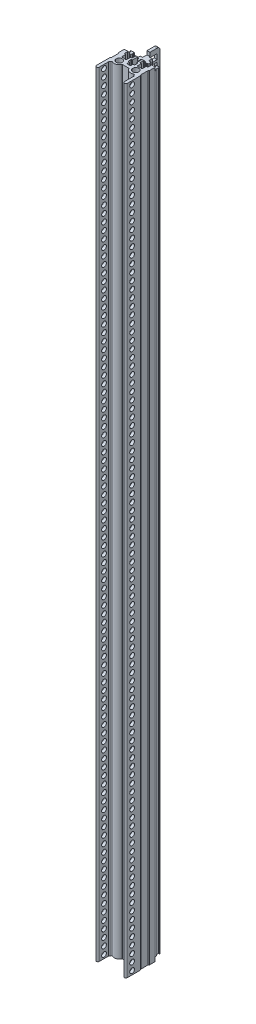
SolidWorks part; units mm, degrees
ref_plane "前视基准面" through (0, 0, 0) normal (0, 0, 1) x (1, 0, 0)
ref_plane "上视基准面" through (0, 0, 0) normal (0, 1, 0) x (1, 0, 0)
ref_plane "右视基准面" through (0, 0, 0) normal (1, 0, 0) x (0, 0, -1)
sketch "草图1" plane through (0, 0, 0) normal (0, 1, 0) x (1, 0, 0)
  line L0 (-2.825, 13.6) -> (-3.725, 13.6)
  line L1 (-8.025, 13.6) -> (-8.025, 11.3)
  line L2 (-3.725, 11.3) -> (-2.825, 11.3)
  line L3 (-3.725, 7.5298) -> (-3.725, 11.3)
  line L4 (-7.125, 11.3) -> (-7.125, 7.8763)
  line L5 (-8.025, 11.3) -> (-7.125, 11.3)
  line L6 (-2.825, 13.6) -> (-2.825, 11.3)
  line L7 (-7.125, 13.6) -> (-8.025, 13.6)
  line L8 (-7.125, 14.6) -> (-7.125, 13.6)
  line L9 (-8.025, 14.6) -> (-7.125, 14.6)
  line L10 (-8.025, 15.8) -> (-8.025, 14.6)
  line L11 (-7.125, 15.8) -> (-8.025, 15.8)
  line L12 (-5.675, 5.25) -> (5.675, 5.25) construction
  line L13 (0, 5.25) -> (0, 10.7319) construction
  line L15 (-10.275, 14.8) -> (-10.275, 13.75)
  line L16 (-9.525, 16.95) -> (-9.525, 15.2)
  line L17 (-10.275, 12.95) -> (-10.375, 12.95) construction
  line L18 (-10.675, 12.65) -> (-10.375, 12.95) construction
  line L19 (-10.675, 9.65) -> (-10.675, 12.65)
  line L20 (-10.2249, 9.1498) -> (-10.675, 9.65)
  line L21 (-10.2249, 9.1498) -> (-10.2251, 4.1498)
  line L22 (-10.675, 3.65) -> (-10.2251, 4.1498)
  line L23 (-10.675, -5.5) -> (-10.675, 3.65)
  line L24 (-8.675, -4.1) -> (-8.675, 0)
  line L25 (-0.675, 20.25) -> (-0.675, 17.75)
  line L26 (-2.075, 20.25) -> (-0.675, 20.25)
  line L27 (-2.075, 17.75) -> (-2.075, 20.25)
  line L28 (-3.725, 17.75) -> (-2.075, 17.75)
  line L29 (-3.725, 15.8) -> (-3.725, 17.75)
  line L30 (-2.825, 15.8) -> (-3.725, 15.8)
  line L31 (-2.825, 14.6) -> (-2.825, 15.8)
  line L32 (-3.725, 14.6) -> (-2.825, 14.6)
  line L33 (-3.725, 13.6) -> (-3.725, 14.6)
  line L34 (-10.675, -5.5) -> (-10.675, 3.65)
  line L35 (-8.675, -5.5) -> (-8.675, 0)
  line L36 (-0.675, 20.25) -> (-0.675, 17.75)
  line L37 (0.675, 20.25) -> (0.675, 17.75)
  line L38 (-2.075, 20.25) -> (-0.675, 20.25)
  line L39 (-2.075, 17.75) -> (-2.075, 20.25)
  line L40 (-3.725, 17.75) -> (-2.075, 17.75)
  line L41 (-3.725, 15.8) -> (-3.725, 17.75)
  line L42 (-2.825, 15.8) -> (-3.725, 15.8)
  line L43 (-2.825, 14.6) -> (-2.825, 15.8)
  line L44 (-3.725, 14.6) -> (-2.825, 14.6)
  line L45 (-3.725, 13.6) -> (-3.725, 14.6)
  line L46 (-2.825, 13.6) -> (-3.725, 13.6)
  line L47 (2.825, 13.6) -> (2.825, 11.3)
  line L48 (-3.725, 11.3) -> (-2.825, 11.3)
  line L49 (-3.725, 7.5298) -> (-3.725, 11.3)
  line L50 (-7.125, 11.3) -> (-7.125, 7.8763)
  line L51 (-8.025, 11.3) -> (-7.125, 11.3)
  line L52 (2.825, 11.3) -> (2.8554, 11.3157)
  line L53 (-7.125, 13.6) -> (-8.025, 13.6)
  line L54 (-7.125, 14.6) -> (-7.125, 13.6)
  line L55 (-8.025, 14.6) -> (-7.125, 14.6)
  line L56 (-8.025, 15.8) -> (-8.025, 14.6)
  line L57 (-7.125, 15.8) -> (-8.025, 15.8)
  line L58 (-10.275, 13.75) -> (-10.375, 13.75)
  line L59 (-9.725, 15) -> (-10.075, 15)
  line L60 (-7.875, 17.75) -> (-9.675, 17.75)
  line L61 (-9.675, 17.75) -> (-9.7164, 17.7086)
  line L62 (-10.225, 17.45) -> (-10.225, 17.35)
  line L63 (-10.275, 12.95) -> (-10.375, 12.95) construction
  line L64 (-10.675, 12.65) -> (-10.375, 12.95) construction
  line L65 (-10.675, 9.65) -> (-10.675, 12.65)
  line L66 (-10.2249, 9.1498) -> (-10.675, 9.65)
  line L67 (-10.2249, 9.1498) -> (-10.2251, 4.1498)
  line L68 (-10.2251, 4.1498) -> (-10.2251, 6.4588)
  line L69 (2.825, 13.6) -> (3.725, 13.6)
  line L70 (8.025, 13.6) -> (8.025, 11.3)
  line L71 (3.725, 11.3) -> (2.825, 11.3)
  line L72 (3.725, 7.5298) -> (3.725, 11.3)
  line L73 (7.125, 11.3) -> (7.125, 7.8763)
  line L74 (8.025, 11.3) -> (7.125, 11.3)
  line L75 (-10.025, 17.15) -> (-9.725, 17.15)
  line L76 (7.125, 13.6) -> (8.025, 13.6)
  line L77 (7.125, 14.6) -> (7.125, 13.6)
  line L78 (8.025, 14.6) -> (7.125, 14.6)
  line L79 (8.025, 15.8) -> (8.025, 14.6)
  line L80 (7.125, 15.8) -> (8.025, 15.8)
  line L81 (-9.8578, 17.65) -> (-10.025, 17.65)
  line L82 (-7.8336, 17.7086) -> (-7.875, 17.75)
  line L83 (-7.325, 17.35) -> (-7.325, 17.45)
  line L85 (7.125, 15.8) -> (7.125, 15.8672)
  line L86 (10.275, 12.95) -> (10.375, 12.95) construction
  line L87 (10.675, 12.65) -> (10.375, 12.95) construction
  line L88 (10.675, 9.65) -> (10.675, 12.65)
  line L89 (10.2249, 9.1498) -> (10.675, 9.65)
  line L90 (10.2249, 9.1498) -> (10.2251, 4.1498)
  line L91 (10.675, 3.65) -> (10.2251, 4.1498)
  line L92 (10.675, -5.5) -> (10.675, 3.65)
  line L93 (8.675, -4.1) -> (8.675, 0)
  line L94 (0.675, 20.25) -> (0.675, 17.75)
  line L95 (2.075, 20.25) -> (0.675, 20.25)
  line L96 (2.075, 17.75) -> (2.075, 20.25)
  line L97 (3.725, 17.75) -> (2.075, 17.75)
  line L98 (3.725, 15.8) -> (3.725, 17.75)
  line L99 (2.825, 15.8) -> (3.725, 15.8)
  line L100 (2.825, 14.6) -> (2.825, 15.8)
  line L101 (3.725, 14.6) -> (2.825, 14.6)
  line L102 (3.725, 13.6) -> (3.725, 14.6)
  line L103 (10.675, -5.5) -> (10.675, 3.65)
  line L104 (8.675, -5.5) -> (8.675, 0)
  line L105 (8.675, 0) -> (-8.675, 0)
  line L106 (0.675, 20.25) -> (0.675, 17.75)
  line L107 (2.075, 20.25) -> (0.675, 20.25)
  line L108 (2.075, 17.75) -> (2.075, 20.25)
  line L109 (3.725, 17.75) -> (2.075, 17.75)
  line L110 (3.725, 15.8) -> (3.725, 17.75)
  line L111 (2.825, 15.8) -> (3.725, 15.8)
  line L112 (2.825, 14.6) -> (2.825, 15.8)
  line L113 (3.725, 14.6) -> (2.825, 14.6)
  line L114 (3.725, 13.6) -> (3.725, 14.6)
  line L115 (2.825, 13.6) -> (3.725, 13.6)
  line L116 (7.1836, 16.0086) -> (7.7664, 16.5914)
  line L117 (3.725, 11.3) -> (2.825, 11.3)
  line L118 (3.725, 7.5298) -> (3.725, 11.3)
  line L119 (7.125, 11.3) -> (7.125, 7.8763)
  line L120 (8.025, 11.3) -> (7.125, 11.3)
  line L121 (7.825, 16.7328) -> (7.825, 16.95)
  line L122 (7.125, 13.6) -> (8.025, 13.6)
  line L123 (7.125, 14.6) -> (7.125, 13.6)
  line L124 (8.025, 14.6) -> (7.125, 14.6)
  line L125 (8.025, 15.8) -> (8.025, 14.6)
  line L126 (7.125, 15.8) -> (8.025, 15.8)
  line L127 (7.625, 17.15) -> (7.525, 17.15)
  line L128 (7.325, 17.35) -> (7.325, 17.45)
  line L129 (7.525, 17.65) -> (7.6922, 17.65)
  line L130 (7.8336, 17.7086) -> (7.875, 17.75)
  line L131 (9.725, 15) -> (10.075, 15)
  line L132 (10.275, 12.95) -> (10.375, 12.95) construction
  line L133 (10.675, 12.65) -> (10.375, 12.95) construction
  line L134 (10.675, 9.65) -> (10.675, 12.65)
  line L135 (10.2249, 9.1498) -> (10.675, 9.65)
  line L136 (10.2249, 9.1498) -> (10.2251, 4.1498)
  line L137 (10.2251, 4.1498) -> (10.2251, 6.4588)
  line L138 (-0.675, 17.75) -> (0.675, 17.75)
  line L139 (-7.125, 16.775) -> (-3.725, 16.775) construction
  line L140 (-5.425, 16.775) -> (-5.425, 11.3) construction
  line L141 (3.725, 16.775) -> (7.125, 16.775) construction
  line L142 (5.425, 16.775) -> (5.425, 12.65) construction
  line L143 (9.8578, 17.65) -> (10.025, 17.65)
  line L144 (10.025, 17.15) -> (9.725, 17.15)
  line L145 (10.225, 17.45) -> (10.225, 17.35)
  line L146 (9.675, 17.75) -> (9.7164, 17.7086)
  line L147 (9.525, 16.95) -> (9.525, 15.2)
  line L148 (7.875, 17.75) -> (9.675, 17.75)
  line L149 (10.275, 14.8) -> (10.275, 13.75)
  line L150 (-7.825, 16.7328) -> (-7.825, 16.95)
  line L151 (-7.125, 15.8) -> (-7.125, 15.8672)
  line L152 (-7.525, 17.65) -> (-7.6922, 17.65)
  line L153 (-7.625, 17.15) -> (-7.525, 17.15)
  line L154 (-7.1836, 16.0086) -> (-7.7664, 16.5914)
  line L155 (-10.375, 13.75) -> (-10.675, 13.45)
  line L156 (-10.675, 13.45) -> (-10.675, 12.65)
  line L157 (10.675, 13.45) -> (10.675, 12.65)
  line L158 (10.375, 13.75) -> (10.675, 13.45)
  line L159 (10.275, 13.75) -> (10.375, 13.75)
  arc A1 (-10.675, -5.5) -> (-8.675, -5.5) centre (-9.675, -5.5) ccw
  arc A2 (-10.675, -5.5) -> (-8.675, -5.5) centre (-9.675, -5.5) ccw
  circle A4 centre (-5.675, 5.25) radius 1.6
  arc A6 (8.675, -5.5) -> (10.675, -5.5) centre (9.675, -5.5) ccw
  arc A7 (8.675, -5.5) -> (10.675, -5.5) centre (9.675, -5.5) ccw
  circle A9 centre (5.675, 5.25) radius 1.6
  arc A10 (7.1836, 16.0086) -> (7.125, 15.8672) centre (7.325, 15.8672) ccw
  arc A11 (7.7664, 16.5914) -> (7.825, 16.7328) centre (7.625, 16.7328) ccw
  arc A12 (7.825, 16.95) -> (7.625, 17.15) centre (7.625, 16.95) ccw
  arc A13 (7.325, 17.35) -> (7.525, 17.15) centre (7.525, 17.35) ccw
  arc A14 (7.525, 17.65) -> (7.325, 17.45) centre (7.525, 17.45) ccw
  arc A15 (10.275, 14.8) -> (10.075, 15) centre (10.075, 14.8) ccw
  arc A16 (10.225, 17.45) -> (10.025, 17.65) centre (10.025, 17.45) ccw
  arc A17 (9.725, 17.15) -> (9.525, 16.95) centre (9.725, 16.95) ccw
  arc A18 (10.025, 17.15) -> (10.225, 17.35) centre (10.025, 17.35) ccw
  arc A19 (9.7164, 17.7086) -> (9.8578, 17.65) centre (9.8578, 17.85) ccw
  arc A20 (9.525, 15.2) -> (9.725, 15) centre (9.725, 15.2) ccw
  arc A21 (7.6922, 17.65) -> (7.8336, 17.7086) centre (7.6922, 17.85) ccw
  arc A22 (-9.525, 15.2) -> (-9.725, 15) centre (-9.725, 15.2) cw
  arc A23 (-10.275, 14.8) -> (-10.075, 15) centre (-10.075, 14.8) cw
  arc A24 (-9.7164, 17.7086) -> (-9.8578, 17.65) centre (-9.8578, 17.85) cw
  arc A25 (-10.025, 17.15) -> (-10.225, 17.35) centre (-10.025, 17.35) cw
  arc A26 (-9.725, 17.15) -> (-9.525, 16.95) centre (-9.725, 16.95) cw
  arc A27 (-10.225, 17.45) -> (-10.025, 17.65) centre (-10.025, 17.45) cw
  arc A28 (-7.7664, 16.5914) -> (-7.825, 16.7328) centre (-7.625, 16.7328) cw
  arc A29 (-7.1836, 16.0086) -> (-7.125, 15.8672) centre (-7.325, 15.8672) cw
  arc A30 (-7.6922, 17.65) -> (-7.8336, 17.7086) centre (-7.6922, 17.85) cw
  arc A31 (-7.525, 17.65) -> (-7.325, 17.45) centre (-7.525, 17.45) cw
  arc A32 (-7.325, 17.35) -> (-7.525, 17.15) centre (-7.525, 17.35) cw
  arc A33 (-7.825, 16.95) -> (-7.625, 17.15) centre (-7.625, 16.95) cw
  arc A34 (-3.725, 7.5298) -> (-7.125, 7.8763) centre (-5.675, 5.25) ccw
  arc A35 (7.125, 7.8763) -> (3.725, 7.5298) centre (5.675, 5.25) ccw
  dimension "D4" = 11.35
  dimension "D5" = 3.2
  dimension "D6" = 6
  dimension "D7" = 0.1
  dimension "D1" = 5.2
  dimension "D2" = 5.2
  dimension "D3" = 15
  dimension "D8" = 0.8
extrude "凸台-拉伸1" add sketch "草图1" along normal mid plane 533.4
sketch "草图4" plane through (0, 266.7, 0) normal (0, 1, 0) x (1, 0, 0)
  line L1 (-2.075, 17.75) -> (-0.075, 17.75)
  line L2 (-2.075, 17.75) -> (-2.075, 27.75)
  line L3 (-2.075, 27.75) -> (-0.075, 27.75)
  line L4 (-0.075, 17.75) -> (-0.075, 27.75)
  dimension "D1" = 2
  dimension "D2" = 10
extrude "凸台-拉伸2" add sketch "草图4" against normal up to surface (533.4 mm away)
sketch "草图17" plane through (0, 266.7, 0) normal (0, 1, 0) x (1, 0, 0)
  line L0 (7.125, 13.6) -> (8.025, 13.6) construction
  line L1 (8.125, 13.6) -> (2.725, 13.6)
  line L2 (8.125, 13.6) -> (8.125, 11.1)
  line L3 (8.125, 11.1) -> (2.725, 11.1)
  line L4 (2.725, 13.6) -> (2.725, 11.1)
  line L5 (7.125, 15.8) -> (8.025, 15.8) construction
  line L6 (8.125, 15.8) -> (2.725, 15.8)
  line L7 (8.125, 15.8) -> (8.125, 14.6)
  line L8 (8.125, 14.6) -> (2.725, 14.6)
  line L9 (2.725, 15.8) -> (2.725, 14.6)
  line L10 (3.725, 14.6) -> (2.825, 14.6) construction
  line L11 (-2.825, 15.8) -> (-3.725, 15.8) construction
  line L12 (-2.725, 15.8) -> (-8.125, 15.8)
  line L13 (-2.725, 15.8) -> (-2.725, 14.6)
  line L14 (-2.725, 14.6) -> (-8.125, 14.6)
  line L15 (-8.125, 15.8) -> (-8.125, 14.6)
  line L16 (-8.025, 14.6) -> (-7.125, 14.6) construction
  line L17 (-2.825, 13.6) -> (-3.725, 13.6) construction
  line L18 (-2.725, 13.6) -> (-8.125, 13.6)
  line L19 (-2.725, 13.6) -> (-2.725, 11.1)
  line L20 (-2.725, 11.1) -> (-8.125, 11.1)
  line L21 (-8.125, 13.6) -> (-8.125, 11.1)
  line L22 (8.025, 13.6) -> (8.025, 11.3) construction
  line L23 (2.825, 13.6) -> (2.825, 11.3) construction
  line L24 (3.725, 11.3) -> (2.825, 11.3) construction
  line L25 (-2.825, 13.6) -> (-2.825, 11.3) construction
  line L26 (-8.025, 13.6) -> (-8.025, 11.3) construction
  dimension "D1" = 0.1
  dimension "D2" = 0.1
  dimension "D3" = 0.2
  dimension "D4" = 0.1
  dimension "D5" = 0.1
extrude "切除-拉伸10" cut sketch "草图17" against normal through all
fillet "圆角4" radius 0.2 16 edges at (8.125, 0, -11.1) (2.725, 0, -13.6) (8.125, 0, -13.6) (2.725, 0, -11.1) (8.125, 0, -14.6) (2.725, 0, -15.8) (8.125, 0, -15.8) (2.725, 0, -14.6) (-2.725, 0, -14.6) (-8.125, 0, -15.8) (-2.725, 0, -15.8) (-8.125, 0, -14.6) (-2.725, 0, -11.1) (-2.725, 0, -13.6) (-8.125, 0, -11.1) (-8.125, 0, -13.6)
sketch "草图14" plane through (0, 266.7, 0) normal (0, 1, 0) x (1, 0, 0)
  line L0 (-0.075, 17.75) -> (-0.575, 17.75)
  line L1 (-0.575, 17.75) -> (-0.575, 19.25)
  line L2 (-0.575, 19.25) -> (-0.075, 19.75)
  line L3 (-0.075, 17.75) -> (-0.075, 27.75) construction
  line L4 (-0.075, 19.75) -> (-0.075, 17.75)
  line L5 (0.675, 20.25) -> (1.675, 20.25)
  line L6 (2.075, 20.25) -> (0.675, 20.25) construction
  line L7 (1.675, 20.25) -> (0.675, 19.25)
  line L8 (0.675, 20.25) -> (0.675, 17.75) construction
  line L9 (0.675, 19.25) -> (0.675, 20.25)
  dimension "D1" = 45
  dimension "D2" = 0.5
  dimension "D3" = 0.5
  dimension "D4" = 1
  dimension "D5" = 1
extrude "切除-拉伸7" cut sketch "草图14" against normal through all
sketch "草图19" plane through (0, 266.7, 0) normal (0, 1, 0) x (1, 0, 0)
  line L1 (2.075, 20.25) -> (-0.575, 20.25)
  line L2 (2.075, 20.25) -> (2.075, 17.75)
  line L3 (2.075, 17.75) -> (-0.575, 17.75)
  line L4 (-0.575, 20.25) -> (-0.575, 17.75)
extrude "凸台-拉伸3" add sketch "草图19" against normal up to surface (533.4 mm away)
sketch "草图6" plane through (0, -266.7, 0) normal (0, -1, 0) x (-1, 0, 0)
  line L0 (0, 0) -> (0, 12.9416) construction
  line L1 (8.675, 0) -> (8.675, 1)
  line L2 (-7.6934, 2.3906) -> (-8.675, 1)
  line L3 (7.6934, 2.3906) -> (8.675, 1)
  line L4 (-8.675, 0) -> (-8.675, 1)
  line L5 (-3.725, 17.75) -> (-2.075, 17.75) construction
  line L7 (2.25, 7.75) -> (2.25, 10.25)
  line L8 (8.675, 0) -> (-8.675, 0)
  line L9 (8.675, -5.5) -> (8.675, 0) construction
  line L10 (-2.4058, 4) -> (2.4058, 4)
  line L11 (2.25, 10.25) -> (1.5, 10.25)
  line L12 (1.5, 10.25) -> (1.5, 16.25)
  line L13 (-1.5, 10.25) -> (-1.5, 16.25)
  line L14 (-2.25, 10.25) -> (-1.5, 10.25)
  line L15 (-2.25, 7.75) -> (-2.25, 10.25)
  line L16 (2.25, 7.75) -> (1.25, 7.75)
  line L17 (1.25, 7.75) -> (1.25, 6)
  line L18 (-1.25, 7.75) -> (-1.25, 6)
  line L19 (-2.25, 7.75) -> (-1.25, 7.75)
  line L20 (1.25, 6) -> (-1.25, 6)
  line L21 (1.5, 16.25) -> (-1.5, 16.25)
  arc A0 (2.4058, 4) -> (7.6934, 2.3906) centre (5.675, 5.25) ccw
  arc A1 (-2.4058, 4) -> (-7.6934, 2.3906) centre (-5.675, 5.25) cw
  dimension "D1" = 7
  dimension "D3" = 4
  dimension "D2" = 1
  dimension "D4" = 1.5
  dimension "D6" = 2
  dimension "D7" = 2.5
  dimension "D8" = 3
  dimension "D9" = 4.5
  dimension "D10" = 6
  dimension "D11" = 2.5
extrude "切除-拉伸4" cut sketch "草图6" against normal through all
sketch "草图2" plane through (10.675, 0, 0) normal (1, 0, 0) x (0, 0, -1)
  line L0 (20.25, 0) -> (52.8609, 0) construction
  line L1 (20.75, 266.7) -> (13.75, 266.7)
  line L2 (20.75, 266.7) -> (20.75, 264.16)
  line L3 (20.75, 264.16) -> (13.75, 264.16)
  line L4 (13.75, 266.7) -> (13.75, 264.16)
  line L5 (20.25, 266.7) -> (20.25, -266.7) construction
  line L6 (13.75, -266.7) -> (13.75, -264.16)
  line L7 (20.75, -264.16) -> (13.75, -264.16)
  line L8 (20.75, -266.7) -> (20.75, -264.16)
  line L9 (20.75, -266.7) -> (13.75, -266.7)
  line L11 (17.75, 266.7) -> (27.75, 266.7) construction
  line L12 (27.75, -266.7) -> (27.75, 266.7) construction
  dimension "D1" = 7
  dimension "D2" = 2.54
  dimension "D3" = 7
extrude "切除-拉伸1" cut sketch "草图2" against normal through all
sketch "草图3" plane through (10.675, 0, 0) normal (1, 0, 0) x (0, 0, -1)
  line L0 (-6.5, 266.7) -> (-6.5, -266.7) construction
  line L1 (-5.5, 266.7) -> (3.65, 266.7) construction
  circle A0 centre (-2.25, 264.16) radius 1.65
  circle A1 centre (-2.25, 259.08) radius 1.65
  circle A2 centre (-2.25, 254) radius 1.65
  circle A3 centre (-2.25, 248.92) radius 1.65
  circle A4 centre (-2.25, 243.84) radius 1.65
  circle A5 centre (-2.25, 238.76) radius 1.65
  circle A6 centre (-2.25, 233.68) radius 1.65
  circle A7 centre (-2.25, 228.6) radius 1.65
  circle A8 centre (-2.25, 223.52) radius 1.65
  circle A9 centre (-2.25, 218.44) radius 1.65
  circle A10 centre (-2.25, 213.36) radius 1.65
  circle A11 centre (-2.25, 208.28) radius 1.65
  circle A12 centre (-2.25, 203.2) radius 1.65
  circle A13 centre (-2.25, 198.12) radius 1.65
  circle A14 centre (-2.25, 193.04) radius 1.65
  circle A15 centre (-2.25, 187.96) radius 1.65
  circle A16 centre (-2.25, 182.88) radius 1.65
  circle A17 centre (-2.25, 177.8) radius 1.65
  circle A18 centre (-2.25, 172.72) radius 1.65
  circle A19 centre (-2.25, 167.64) radius 1.65
  circle A20 centre (-2.25, 162.56) radius 1.65
  circle A21 centre (-2.25, 157.48) radius 1.65
  circle A22 centre (-2.25, 152.4) radius 1.65
  circle A23 centre (-2.25, 147.32) radius 1.65
  circle A24 centre (-2.25, 142.24) radius 1.65
  circle A25 centre (-2.25, 137.16) radius 1.65
  circle A26 centre (-2.25, 132.08) radius 1.65
  circle A27 centre (-2.25, 127) radius 1.65
  circle A28 centre (-2.25, 121.92) radius 1.65
  circle A29 centre (-2.25, 116.84) radius 1.65
  circle A30 centre (-2.25, 111.76) radius 1.65
  circle A31 centre (-2.25, 106.68) radius 1.65
  circle A32 centre (-2.25, 101.6) radius 1.65
  circle A33 centre (-2.25, 96.52) radius 1.65
  circle A34 centre (-2.25, 91.44) radius 1.65
  circle A35 centre (-2.25, 86.36) radius 1.65
  circle A36 centre (-2.25, 81.28) radius 1.65
  circle A37 centre (-2.25, 76.2) radius 1.65
  circle A38 centre (-2.25, 71.12) radius 1.65
  circle A39 centre (-2.25, 66.04) radius 1.65
  circle A40 centre (-2.25, 60.96) radius 1.65
  circle A41 centre (-2.25, 55.88) radius 1.65
  circle A42 centre (-2.25, 50.8) radius 1.65
  circle A43 centre (-2.25, 45.72) radius 1.65
  circle A44 centre (-2.25, 40.64) radius 1.65
  circle A45 centre (-2.25, 35.56) radius 1.65
  circle A46 centre (-2.25, 30.48) radius 1.65
  circle A47 centre (-2.25, 25.4) radius 1.65
  circle A48 centre (-2.25, 20.32) radius 1.65
  circle A49 centre (-2.25, 15.24) radius 1.65
  circle A50 centre (-2.25, 10.16) radius 1.65
  circle A51 centre (-2.25, 5.08) radius 1.65
  circle A52 centre (-2.25, 0) radius 1.65
  circle A53 centre (-2.25, -5.08) radius 1.65
  circle A54 centre (-2.25, -10.16) radius 1.65
  circle A55 centre (-2.25, -15.24) radius 1.65
  circle A56 centre (-2.25, -20.32) radius 1.65
  circle A57 centre (-2.25, -25.4) radius 1.65
  circle A58 centre (-2.25, -30.48) radius 1.65
  circle A59 centre (-2.25, -35.56) radius 1.65
  circle A60 centre (-2.25, -40.64) radius 1.65
  circle A61 centre (-2.25, -45.72) radius 1.65
  circle A62 centre (-2.25, -50.8) radius 1.65
  circle A63 centre (-2.25, -55.88) radius 1.65
  circle A64 centre (-2.25, -60.96) radius 1.65
  circle A65 centre (-2.25, -66.04) radius 1.65
  circle A66 centre (-2.25, -71.12) radius 1.65
  circle A67 centre (-2.25, -76.2) radius 1.65
  circle A68 centre (-2.25, -81.28) radius 1.65
  circle A69 centre (-2.25, -86.36) radius 1.65
  circle A70 centre (-2.25, -91.44) radius 1.65
  circle A71 centre (-2.25, -96.52) radius 1.65
  circle A72 centre (-2.25, -101.6) radius 1.65
  circle A73 centre (-2.25, -106.68) radius 1.65
  circle A74 centre (-2.25, -111.76) radius 1.65
  circle A75 centre (-2.25, -116.84) radius 1.65
  circle A76 centre (-2.25, -121.92) radius 1.65
  circle A77 centre (-2.25, -127) radius 1.65
  circle A78 centre (-2.25, -132.08) radius 1.65
  circle A79 centre (-2.25, -137.16) radius 1.65
  circle A80 centre (-2.25, -142.24) radius 1.65
  circle A81 centre (-2.25, -147.32) radius 1.65
  circle A82 centre (-2.25, -152.4) radius 1.65
  circle A83 centre (-2.25, -157.48) radius 1.65
  circle A84 centre (-2.25, -162.56) radius 1.65
  circle A85 centre (-2.25, -182.88) radius 1.65
  circle A86 centre (-2.25, -213.36) radius 1.65
  circle A87 centre (-2.25, -177.8) radius 1.65
  circle A88 centre (-2.25, -233.68) radius 1.65
  circle A89 centre (-2.25, -193.04) radius 1.65
  circle A90 centre (-2.25, -218.44) radius 1.65
  circle A91 centre (-2.25, -172.72) radius 1.65
  circle A92 centre (-2.25, -203.2) radius 1.65
  circle A93 centre (-2.25, -248.92) radius 1.65
  circle A94 centre (-2.25, -238.76) radius 1.65
  circle A95 centre (-2.25, -198.12) radius 1.65
  circle A96 centre (-2.25, -223.52) radius 1.65
  circle A97 centre (-2.25, -187.96) radius 1.65
  circle A98 centre (-2.25, -208.28) radius 1.65
  circle A99 centre (-2.25, -167.64) radius 1.65
  circle A100 centre (-2.25, -243.84) radius 1.65
  circle A101 centre (-2.25, -228.6) radius 1.65
  circle A104 centre (-2.25, -264.16) radius 1.65
  circle A108 centre (-2.25, -259.08) radius 1.65
  circle A116 centre (-2.25, -254) radius 1.65
  dimension "D1" = 4.25
  dimension "D3" = 3.3
  dimension "D2" = 2.54
  dimension "D4" = 85
extrude "切除-拉伸2" cut sketch "草图3" against normal through all
sketch "草图5" plane through (-2.075, 0, 0) normal (-1, 0, 0) x (0, 0, 1)
  line L0 (-27.75, -266.7) -> (-27.75, 266.7) construction
  line L1 (-25.75, -259.82) -> (-20.25, -259.82)
  line L2 (-25.75, -259.82) -> (-25.75, -263.42)
  line L3 (-25.75, -263.42) -> (-20.25, -263.42)
  line L4 (-20.25, -259.82) -> (-20.25, -263.42)
  line L5 (-20.75, -266.7) -> (-27.75, -266.7) construction
  line L6 (-25.75, -254.74) -> (-20.25, -254.74)
  line L7 (-25.75, -254.74) -> (-25.75, -258.34)
  line L8 (-25.75, -258.34) -> (-20.25, -258.34)
  line L9 (-20.25, -254.74) -> (-20.25, -258.34)
  line L10 (-25.75, -249.66) -> (-20.25, -249.66)
  line L11 (-25.75, -249.66) -> (-25.75, -253.26)
  line L12 (-25.75, -253.26) -> (-20.25, -253.26)
  line L13 (-20.25, -249.66) -> (-20.25, -253.26)
  line L14 (-25.75, -244.58) -> (-20.25, -244.58)
  line L15 (-25.75, -244.58) -> (-25.75, -248.18)
  line L16 (-25.75, -248.18) -> (-20.25, -248.18)
  line L17 (-20.25, -244.58) -> (-20.25, -248.18)
  line L18 (-25.75, -239.5) -> (-20.25, -239.5)
  line L19 (-25.75, -239.5) -> (-25.75, -243.1)
  line L20 (-25.75, -243.1) -> (-20.25, -243.1)
  line L21 (-20.25, -239.5) -> (-20.25, -243.1)
  line L22 (-25.75, -234.42) -> (-20.25, -234.42)
  line L23 (-25.75, -234.42) -> (-25.75, -238.02)
  line L24 (-25.75, -238.02) -> (-20.25, -238.02)
  line L25 (-20.25, -234.42) -> (-20.25, -238.02)
  line L26 (-25.75, -229.34) -> (-20.25, -229.34)
  line L27 (-25.75, -229.34) -> (-25.75, -232.94)
  line L28 (-25.75, -232.94) -> (-20.25, -232.94)
  line L29 (-20.25, -229.34) -> (-20.25, -232.94)
  line L30 (-25.75, -224.26) -> (-20.25, -224.26)
  line L31 (-25.75, -224.26) -> (-25.75, -227.86)
  line L32 (-25.75, -227.86) -> (-20.25, -227.86)
  line L33 (-20.25, -224.26) -> (-20.25, -227.86)
  line L34 (-25.75, -219.18) -> (-20.25, -219.18)
  line L35 (-25.75, -219.18) -> (-25.75, -222.78)
  line L36 (-25.75, -222.78) -> (-20.25, -222.78)
  line L37 (-20.25, -219.18) -> (-20.25, -222.78)
  line L38 (-25.75, -214.1) -> (-20.25, -214.1)
  line L39 (-25.75, -214.1) -> (-25.75, -217.7)
  line L40 (-25.75, -217.7) -> (-20.25, -217.7)
  line L41 (-20.25, -214.1) -> (-20.25, -217.7)
  line L42 (-25.75, -209.02) -> (-20.25, -209.02)
  line L43 (-25.75, -209.02) -> (-25.75, -212.62)
  line L44 (-25.75, -212.62) -> (-20.25, -212.62)
  line L45 (-20.25, -209.02) -> (-20.25, -212.62)
  line L46 (-25.75, -203.94) -> (-20.25, -203.94)
  line L47 (-25.75, -203.94) -> (-25.75, -207.54)
  line L48 (-25.75, -207.54) -> (-20.25, -207.54)
  line L49 (-20.25, -203.94) -> (-20.25, -207.54)
  line L50 (-25.75, -198.86) -> (-20.25, -198.86)
  line L51 (-25.75, -198.86) -> (-25.75, -202.46)
  line L52 (-25.75, -202.46) -> (-20.25, -202.46)
  line L53 (-20.25, -198.86) -> (-20.25, -202.46)
  line L54 (-25.75, -193.78) -> (-20.25, -193.78)
  line L55 (-25.75, -193.78) -> (-25.75, -197.38)
  line L56 (-25.75, -197.38) -> (-20.25, -197.38)
  line L57 (-20.25, -193.78) -> (-20.25, -197.38)
  line L58 (-25.75, -188.7) -> (-20.25, -188.7)
  line L59 (-25.75, -188.7) -> (-25.75, -192.3)
  line L60 (-25.75, -192.3) -> (-20.25, -192.3)
  line L61 (-20.25, -188.7) -> (-20.25, -192.3)
  line L62 (-25.75, -183.62) -> (-20.25, -183.62)
  line L63 (-25.75, -183.62) -> (-25.75, -187.22)
  line L64 (-25.75, -187.22) -> (-20.25, -187.22)
  line L65 (-20.25, -183.62) -> (-20.25, -187.22)
  line L66 (-25.75, -178.54) -> (-20.25, -178.54)
  line L67 (-25.75, -178.54) -> (-25.75, -182.14)
  line L68 (-25.75, -182.14) -> (-20.25, -182.14)
  line L69 (-20.25, -178.54) -> (-20.25, -182.14)
  line L70 (-25.75, -173.46) -> (-20.25, -173.46)
  line L71 (-25.75, -173.46) -> (-25.75, -177.06)
  line L72 (-25.75, -177.06) -> (-20.25, -177.06)
  line L73 (-20.25, -173.46) -> (-20.25, -177.06)
  line L74 (-25.75, -168.38) -> (-20.25, -168.38)
  line L75 (-25.75, -168.38) -> (-25.75, -171.98)
  line L76 (-25.75, -171.98) -> (-20.25, -171.98)
  line L77 (-20.25, -168.38) -> (-20.25, -171.98)
  line L78 (-25.75, -163.3) -> (-20.25, -163.3)
  line L79 (-25.75, -163.3) -> (-25.75, -166.9)
  line L80 (-25.75, -166.9) -> (-20.25, -166.9)
  line L81 (-20.25, -163.3) -> (-20.25, -166.9)
  line L82 (-25.75, -158.22) -> (-20.25, -158.22)
  line L83 (-25.75, -158.22) -> (-25.75, -161.82)
  line L84 (-25.75, -161.82) -> (-20.25, -161.82)
  line L85 (-20.25, -158.22) -> (-20.25, -161.82)
  line L86 (-25.75, -153.14) -> (-20.25, -153.14)
  line L87 (-25.75, -153.14) -> (-25.75, -156.74)
  line L88 (-25.75, -156.74) -> (-20.25, -156.74)
  line L89 (-20.25, -153.14) -> (-20.25, -156.74)
  line L90 (-25.75, -148.06) -> (-20.25, -148.06)
  line L91 (-25.75, -148.06) -> (-25.75, -151.66)
  line L92 (-25.75, -151.66) -> (-20.25, -151.66)
  line L93 (-20.25, -148.06) -> (-20.25, -151.66)
  line L94 (-25.75, -142.98) -> (-20.25, -142.98)
  line L95 (-25.75, -142.98) -> (-25.75, -146.58)
  line L96 (-25.75, -146.58) -> (-20.25, -146.58)
  line L97 (-20.25, -142.98) -> (-20.25, -146.58)
  line L98 (-25.75, -137.9) -> (-20.25, -137.9)
  line L99 (-25.75, -137.9) -> (-25.75, -141.5)
  line L100 (-25.75, -141.5) -> (-20.25, -141.5)
  line L101 (-20.25, -137.9) -> (-20.25, -141.5)
  line L102 (-25.75, -132.82) -> (-20.25, -132.82)
  line L103 (-25.75, -132.82) -> (-25.75, -136.42)
  line L104 (-25.75, -136.42) -> (-20.25, -136.42)
  line L105 (-20.25, -132.82) -> (-20.25, -136.42)
  line L106 (-25.75, -127.74) -> (-20.25, -127.74)
  line L107 (-25.75, -127.74) -> (-25.75, -131.34)
  line L108 (-25.75, -131.34) -> (-20.25, -131.34)
  line L109 (-20.25, -127.74) -> (-20.25, -131.34)
  line L110 (-25.75, -122.66) -> (-20.25, -122.66)
  line L111 (-25.75, -122.66) -> (-25.75, -126.26)
  line L112 (-25.75, -126.26) -> (-20.25, -126.26)
  line L113 (-20.25, -122.66) -> (-20.25, -126.26)
  line L114 (-25.75, -117.58) -> (-20.25, -117.58)
  line L115 (-25.75, -117.58) -> (-25.75, -121.18)
  line L116 (-25.75, -121.18) -> (-20.25, -121.18)
  line L117 (-20.25, -117.58) -> (-20.25, -121.18)
  line L118 (-25.75, -112.5) -> (-20.25, -112.5)
  line L119 (-25.75, -112.5) -> (-25.75, -116.1)
  line L120 (-25.75, -116.1) -> (-20.25, -116.1)
  line L121 (-20.25, -112.5) -> (-20.25, -116.1)
  line L122 (-25.75, -107.42) -> (-20.25, -107.42)
  line L123 (-25.75, -107.42) -> (-25.75, -111.02)
  line L124 (-25.75, -111.02) -> (-20.25, -111.02)
  line L125 (-20.25, -107.42) -> (-20.25, -111.02)
  line L126 (-25.75, -102.34) -> (-20.25, -102.34)
  line L127 (-25.75, -102.34) -> (-25.75, -105.94)
  line L128 (-25.75, -105.94) -> (-20.25, -105.94)
  line L129 (-20.25, -102.34) -> (-20.25, -105.94)
  line L130 (-25.75, -97.26) -> (-20.25, -97.26)
  line L131 (-25.75, -97.26) -> (-25.75, -100.86)
  line L132 (-25.75, -100.86) -> (-20.25, -100.86)
  line L133 (-20.25, -97.26) -> (-20.25, -100.86)
  line L134 (-25.75, -92.18) -> (-20.25, -92.18)
  line L135 (-25.75, -92.18) -> (-25.75, -95.78)
  line L136 (-25.75, -95.78) -> (-20.25, -95.78)
  line L137 (-20.25, -92.18) -> (-20.25, -95.78)
  line L138 (-25.75, -87.1) -> (-20.25, -87.1)
  line L139 (-25.75, -87.1) -> (-25.75, -90.7)
  line L140 (-25.75, -90.7) -> (-20.25, -90.7)
  line L141 (-20.25, -87.1) -> (-20.25, -90.7)
  line L142 (-25.75, -82.02) -> (-20.25, -82.02)
  line L143 (-25.75, -82.02) -> (-25.75, -85.62)
  line L144 (-25.75, -85.62) -> (-20.25, -85.62)
  line L145 (-20.25, -82.02) -> (-20.25, -85.62)
  line L146 (-25.75, -76.94) -> (-20.25, -76.94)
  line L147 (-25.75, -76.94) -> (-25.75, -80.54)
  line L148 (-25.75, -80.54) -> (-20.25, -80.54)
  line L149 (-20.25, -76.94) -> (-20.25, -80.54)
  line L150 (-25.75, -71.86) -> (-20.25, -71.86)
  line L151 (-25.75, -71.86) -> (-25.75, -75.46)
  line L152 (-25.75, -75.46) -> (-20.25, -75.46)
  line L153 (-20.25, -71.86) -> (-20.25, -75.46)
  line L154 (-25.75, -66.78) -> (-20.25, -66.78)
  line L155 (-25.75, -66.78) -> (-25.75, -70.38)
  line L156 (-25.75, -70.38) -> (-20.25, -70.38)
  line L157 (-20.25, -66.78) -> (-20.25, -70.38)
  line L158 (-25.75, -61.7) -> (-20.25, -61.7)
  line L159 (-25.75, -61.7) -> (-25.75, -65.3)
  line L160 (-25.75, -65.3) -> (-20.25, -65.3)
  line L161 (-20.25, -61.7) -> (-20.25, -65.3)
  line L162 (-25.75, -56.62) -> (-20.25, -56.62)
  line L163 (-25.75, -56.62) -> (-25.75, -60.22)
  line L164 (-25.75, -60.22) -> (-20.25, -60.22)
  line L165 (-20.25, -56.62) -> (-20.25, -60.22)
  line L166 (-25.75, -51.54) -> (-20.25, -51.54)
  line L167 (-25.75, -51.54) -> (-25.75, -55.14)
  line L168 (-25.75, -55.14) -> (-20.25, -55.14)
  line L169 (-20.25, -51.54) -> (-20.25, -55.14)
  line L170 (-25.75, -46.46) -> (-20.25, -46.46)
  line L171 (-25.75, -46.46) -> (-25.75, -50.06)
  line L172 (-25.75, -50.06) -> (-20.25, -50.06)
  line L173 (-20.25, -46.46) -> (-20.25, -50.06)
  line L174 (-25.75, -41.38) -> (-20.25, -41.38)
  line L175 (-25.75, -41.38) -> (-25.75, -44.98)
  line L176 (-25.75, -44.98) -> (-20.25, -44.98)
  line L177 (-20.25, -41.38) -> (-20.25, -44.98)
  line L178 (-25.75, -36.3) -> (-20.25, -36.3)
  line L179 (-25.75, -36.3) -> (-25.75, -39.9)
  line L180 (-25.75, -39.9) -> (-20.25, -39.9)
  line L181 (-20.25, -36.3) -> (-20.25, -39.9)
  line L182 (-25.75, -31.22) -> (-20.25, -31.22)
  line L183 (-25.75, -31.22) -> (-25.75, -34.82)
  line L184 (-25.75, -34.82) -> (-20.25, -34.82)
  line L185 (-20.25, -31.22) -> (-20.25, -34.82)
  line L186 (-25.75, -26.14) -> (-20.25, -26.14)
  line L187 (-25.75, -26.14) -> (-25.75, -29.74)
  line L188 (-25.75, -29.74) -> (-20.25, -29.74)
  line L189 (-20.25, -26.14) -> (-20.25, -29.74)
  line L190 (-25.75, -21.06) -> (-20.25, -21.06)
  line L191 (-25.75, -21.06) -> (-25.75, -24.66)
  line L192 (-25.75, -24.66) -> (-20.25, -24.66)
  line L193 (-20.25, -21.06) -> (-20.25, -24.66)
  line L194 (-25.75, -15.98) -> (-20.25, -15.98)
  line L195 (-25.75, -15.98) -> (-25.75, -19.58)
  line L196 (-25.75, -19.58) -> (-20.25, -19.58)
  line L197 (-20.25, -15.98) -> (-20.25, -19.58)
  line L198 (-25.75, -10.9) -> (-20.25, -10.9)
  line L199 (-25.75, -10.9) -> (-25.75, -14.5)
  line L200 (-25.75, -14.5) -> (-20.25, -14.5)
  line L201 (-20.25, -10.9) -> (-20.25, -14.5)
  line L202 (-25.75, -5.82) -> (-20.25, -5.82)
  line L203 (-25.75, -5.82) -> (-25.75, -9.42)
  line L204 (-25.75, -9.42) -> (-20.25, -9.42)
  line L205 (-20.25, -5.82) -> (-20.25, -9.42)
  line L206 (-25.75, -0.74) -> (-20.25, -0.74)
  line L207 (-25.75, -0.74) -> (-25.75, -4.34)
  line L208 (-25.75, -4.34) -> (-20.25, -4.34)
  line L209 (-20.25, -0.74) -> (-20.25, -4.34)
  line L210 (-25.75, 4.34) -> (-20.25, 4.34)
  line L211 (-25.75, 4.34) -> (-25.75, 0.74)
  line L212 (-25.75, 0.74) -> (-20.25, 0.74)
  line L213 (-20.25, 4.34) -> (-20.25, 0.74)
  line L214 (-25.75, 9.42) -> (-20.25, 9.42)
  line L215 (-25.75, 9.42) -> (-25.75, 5.82)
  line L216 (-25.75, 5.82) -> (-20.25, 5.82)
  line L217 (-20.25, 9.42) -> (-20.25, 5.82)
  line L218 (-25.75, 14.5) -> (-20.25, 14.5)
  line L219 (-25.75, 14.5) -> (-25.75, 10.9)
  line L220 (-25.75, 10.9) -> (-20.25, 10.9)
  line L221 (-20.25, 14.5) -> (-20.25, 10.9)
  line L222 (-25.75, 19.58) -> (-20.25, 19.58)
  line L223 (-25.75, 19.58) -> (-25.75, 15.98)
  line L224 (-25.75, 15.98) -> (-20.25, 15.98)
  line L225 (-20.25, 19.58) -> (-20.25, 15.98)
  line L226 (-25.75, 24.66) -> (-20.25, 24.66)
  line L227 (-25.75, 24.66) -> (-25.75, 21.06)
  line L228 (-25.75, 21.06) -> (-20.25, 21.06)
  line L229 (-20.25, 24.66) -> (-20.25, 21.06)
  line L230 (-25.75, 29.74) -> (-20.25, 29.74)
  line L231 (-25.75, 29.74) -> (-25.75, 26.14)
  line L232 (-25.75, 26.14) -> (-20.25, 26.14)
  line L233 (-20.25, 29.74) -> (-20.25, 26.14)
  line L234 (-25.75, 34.82) -> (-20.25, 34.82)
  line L235 (-25.75, 34.82) -> (-25.75, 31.22)
  line L236 (-25.75, 31.22) -> (-20.25, 31.22)
  line L237 (-20.25, 34.82) -> (-20.25, 31.22)
  line L238 (-25.75, 39.9) -> (-20.25, 39.9)
  line L239 (-25.75, 39.9) -> (-25.75, 36.3)
  line L240 (-25.75, 36.3) -> (-20.25, 36.3)
  line L241 (-20.25, 39.9) -> (-20.25, 36.3)
  line L242 (-25.75, 44.98) -> (-20.25, 44.98)
  line L243 (-25.75, 44.98) -> (-25.75, 41.38)
  line L244 (-25.75, 41.38) -> (-20.25, 41.38)
  line L245 (-20.25, 44.98) -> (-20.25, 41.38)
  line L246 (-25.75, 50.06) -> (-20.25, 50.06)
  line L247 (-25.75, 50.06) -> (-25.75, 46.46)
  line L248 (-25.75, 46.46) -> (-20.25, 46.46)
  line L249 (-20.25, 50.06) -> (-20.25, 46.46)
  line L250 (-25.75, 55.14) -> (-20.25, 55.14)
  line L251 (-25.75, 55.14) -> (-25.75, 51.54)
  line L252 (-25.75, 51.54) -> (-20.25, 51.54)
  line L253 (-20.25, 55.14) -> (-20.25, 51.54)
  line L254 (-25.75, 60.22) -> (-20.25, 60.22)
  line L255 (-25.75, 60.22) -> (-25.75, 56.62)
  line L256 (-25.75, 56.62) -> (-20.25, 56.62)
  line L257 (-20.25, 60.22) -> (-20.25, 56.62)
  line L258 (-25.75, 65.3) -> (-20.25, 65.3)
  line L259 (-25.75, 65.3) -> (-25.75, 61.7)
  line L260 (-25.75, 61.7) -> (-20.25, 61.7)
  line L261 (-20.25, 65.3) -> (-20.25, 61.7)
  line L262 (-25.75, 70.38) -> (-20.25, 70.38)
  line L263 (-25.75, 70.38) -> (-25.75, 66.78)
  line L264 (-25.75, 66.78) -> (-20.25, 66.78)
  line L265 (-20.25, 70.38) -> (-20.25, 66.78)
  line L266 (-25.75, 75.46) -> (-20.25, 75.46)
  line L267 (-25.75, 75.46) -> (-25.75, 71.86)
  line L268 (-25.75, 71.86) -> (-20.25, 71.86)
  line L269 (-20.25, 75.46) -> (-20.25, 71.86)
  line L270 (-25.75, 80.54) -> (-20.25, 80.54)
  line L271 (-25.75, 80.54) -> (-25.75, 76.94)
  line L272 (-25.75, 76.94) -> (-20.25, 76.94)
  line L273 (-20.25, 80.54) -> (-20.25, 76.94)
  line L274 (-25.75, 85.62) -> (-20.25, 85.62)
  line L275 (-25.75, 85.62) -> (-25.75, 82.02)
  line L276 (-25.75, 82.02) -> (-20.25, 82.02)
  line L277 (-20.25, 85.62) -> (-20.25, 82.02)
  line L278 (-25.75, 90.7) -> (-20.25, 90.7)
  line L279 (-25.75, 90.7) -> (-25.75, 87.1)
  line L280 (-25.75, 87.1) -> (-20.25, 87.1)
  line L281 (-20.25, 90.7) -> (-20.25, 87.1)
  line L282 (-25.75, 95.78) -> (-20.25, 95.78)
  line L283 (-25.75, 95.78) -> (-25.75, 92.18)
  line L284 (-25.75, 92.18) -> (-20.25, 92.18)
  line L285 (-20.25, 95.78) -> (-20.25, 92.18)
  line L286 (-25.75, 100.86) -> (-20.25, 100.86)
  line L287 (-25.75, 100.86) -> (-25.75, 97.26)
  line L288 (-25.75, 97.26) -> (-20.25, 97.26)
  line L289 (-20.25, 100.86) -> (-20.25, 97.26)
  line L290 (-25.75, 105.94) -> (-20.25, 105.94)
  line L291 (-25.75, 105.94) -> (-25.75, 102.34)
  line L292 (-25.75, 102.34) -> (-20.25, 102.34)
  line L293 (-20.25, 105.94) -> (-20.25, 102.34)
  line L294 (-25.75, 111.02) -> (-20.25, 111.02)
  line L295 (-25.75, 111.02) -> (-25.75, 107.42)
  line L296 (-25.75, 107.42) -> (-20.25, 107.42)
  line L297 (-20.25, 111.02) -> (-20.25, 107.42)
  line L298 (-25.75, 116.1) -> (-20.25, 116.1)
  line L299 (-25.75, 116.1) -> (-25.75, 112.5)
  line L300 (-25.75, 112.5) -> (-20.25, 112.5)
  line L301 (-20.25, 116.1) -> (-20.25, 112.5)
  line L302 (-25.75, 121.18) -> (-20.25, 121.18)
  line L303 (-25.75, 121.18) -> (-25.75, 117.58)
  line L304 (-25.75, 117.58) -> (-20.25, 117.58)
  line L305 (-20.25, 121.18) -> (-20.25, 117.58)
  line L306 (-25.75, 126.26) -> (-20.25, 126.26)
  line L307 (-25.75, 126.26) -> (-25.75, 122.66)
  line L308 (-25.75, 122.66) -> (-20.25, 122.66)
  line L309 (-20.25, 126.26) -> (-20.25, 122.66)
  line L310 (-25.75, 131.34) -> (-20.25, 131.34)
  line L311 (-25.75, 131.34) -> (-25.75, 127.74)
  line L312 (-25.75, 127.74) -> (-20.25, 127.74)
  line L313 (-20.25, 131.34) -> (-20.25, 127.74)
  line L314 (-25.75, 136.42) -> (-20.25, 136.42)
  line L315 (-25.75, 136.42) -> (-25.75, 132.82)
  line L316 (-25.75, 132.82) -> (-20.25, 132.82)
  line L317 (-20.25, 136.42) -> (-20.25, 132.82)
  line L318 (-25.75, 141.5) -> (-20.25, 141.5)
  line L319 (-25.75, 141.5) -> (-25.75, 137.9)
  line L320 (-25.75, 137.9) -> (-20.25, 137.9)
  line L321 (-20.25, 141.5) -> (-20.25, 137.9)
  line L322 (-25.75, 146.58) -> (-20.25, 146.58)
  line L323 (-25.75, 146.58) -> (-25.75, 142.98)
  line L324 (-25.75, 142.98) -> (-20.25, 142.98)
  line L325 (-20.25, 146.58) -> (-20.25, 142.98)
  line L326 (-25.75, 151.66) -> (-20.25, 151.66)
  line L327 (-25.75, 151.66) -> (-25.75, 148.06)
  line L328 (-25.75, 148.06) -> (-20.25, 148.06)
  line L329 (-20.25, 151.66) -> (-20.25, 148.06)
  line L330 (-25.75, 156.74) -> (-20.25, 156.74)
  line L331 (-25.75, 156.74) -> (-25.75, 153.14)
  line L332 (-25.75, 153.14) -> (-20.25, 153.14)
  line L333 (-20.25, 156.74) -> (-20.25, 153.14)
  line L334 (-25.75, 161.82) -> (-20.25, 161.82)
  line L335 (-25.75, 161.82) -> (-25.75, 158.22)
  line L336 (-25.75, 158.22) -> (-20.25, 158.22)
  line L337 (-20.25, 161.82) -> (-20.25, 158.22)
  line L338 (-25.75, 173.46) -> (-20.25, 173.46)
  line L339 (-25.75, 188.7) -> (-20.25, 188.7)
  line L340 (-20.25, 212.62) -> (-20.25, 209.02)
  line L341 (-20.25, 182.14) -> (-20.25, 178.54)
  line L342 (-25.75, 202.46) -> (-25.75, 198.86)
  line L343 (-20.25, 202.46) -> (-20.25, 198.86)
  line L344 (-20.25, 227.86) -> (-20.25, 224.26)
  line L345 (-25.75, 163.3) -> (-20.25, 163.3)
  line L346 (-25.75, 183.62) -> (-20.25, 183.62)
  line L347 (-25.75, 212.62) -> (-20.25, 212.62)
  line L348 (-25.75, 178.54) -> (-20.25, 178.54)
  line L349 (-20.25, 217.7) -> (-20.25, 214.1)
  line L350 (-25.75, 166.9) -> (-20.25, 166.9)
  line L351 (-25.75, 187.22) -> (-25.75, 183.62)
  line L352 (-25.75, 214.1) -> (-20.25, 214.1)
  line L353 (-25.75, 219.18) -> (-20.25, 219.18)
  line L354 (-20.25, 177.06) -> (-20.25, 173.46)
  line L355 (-25.75, 197.38) -> (-25.75, 193.78)
  line L356 (-25.75, 187.22) -> (-20.25, 187.22)
  line L357 (-25.75, 192.3) -> (-25.75, 188.7)
  line L358 (-20.25, 166.9) -> (-20.25, 163.3)
  line L359 (-25.75, 197.38) -> (-20.25, 197.38)
  line L360 (-25.75, 177.06) -> (-20.25, 177.06)
  line L361 (-25.75, 203.94) -> (-20.25, 203.94)
  line L362 (-25.75, 217.7) -> (-25.75, 214.1)
  line L363 (-25.75, 224.26) -> (-20.25, 224.26)
  line L364 (-25.75, 177.06) -> (-25.75, 173.46)
  line L365 (-25.75, 212.62) -> (-25.75, 209.02)
  line L366 (-25.75, 222.78) -> (-20.25, 222.78)
  line L367 (-25.75, 171.98) -> (-20.25, 171.98)
  line L368 (-25.75, 192.3) -> (-20.25, 192.3)
  line L369 (-20.25, 222.78) -> (-20.25, 219.18)
  line L370 (-25.75, 171.98) -> (-25.75, 168.38)
  line L371 (-25.75, 217.7) -> (-20.25, 217.7)
  line L372 (-25.75, 168.38) -> (-20.25, 168.38)
  line L373 (-20.25, 192.3) -> (-20.25, 188.7)
  line L374 (-25.75, 202.46) -> (-20.25, 202.46)
  line L375 (-25.75, 182.14) -> (-20.25, 182.14)
  line L376 (-25.75, 198.86) -> (-20.25, 198.86)
  line L377 (-25.75, 227.86) -> (-20.25, 227.86)
  line L378 (-25.75, 227.86) -> (-25.75, 224.26)
  line L379 (-25.75, 207.54) -> (-20.25, 207.54)
  line L380 (-20.25, 207.54) -> (-20.25, 203.94)
  line L381 (-25.75, 166.9) -> (-25.75, 163.3)
  line L382 (-25.75, 182.14) -> (-25.75, 178.54)
  line L383 (-20.25, 187.22) -> (-20.25, 183.62)
  line L384 (-20.25, 197.38) -> (-20.25, 193.78)
  line L385 (-25.75, 207.54) -> (-25.75, 203.94)
  line L386 (-25.75, 209.02) -> (-20.25, 209.02)
  line L387 (-20.25, 171.98) -> (-20.25, 168.38)
  line L388 (-25.75, 193.78) -> (-20.25, 193.78)
  line L389 (-25.75, 222.78) -> (-25.75, 219.18)
  line L390 (-25.75, 239.5) -> (-20.25, 239.5)
  line L391 (-25.75, 254.74) -> (-20.25, 254.74)
  line L393 (-20.25, 248.18) -> (-20.25, 244.58)
  line L397 (-25.75, 229.34) -> (-20.25, 229.34)
  line L398 (-25.75, 249.66) -> (-20.25, 249.66)
  line L400 (-25.75, 244.58) -> (-20.25, 244.58)
  line L402 (-25.75, 232.94) -> (-20.25, 232.94)
  line L403 (-25.75, 253.26) -> (-25.75, 249.66)
  line L406 (-20.25, 243.1) -> (-20.25, 239.5)
  line L407 (-25.75, 263.42) -> (-25.75, 259.82)
  line L408 (-25.75, 253.26) -> (-20.25, 253.26)
  line L409 (-25.75, 258.34) -> (-25.75, 254.74)
  line L410 (-20.25, 232.94) -> (-20.25, 229.34)
  line L411 (-25.75, 263.42) -> (-20.25, 263.42)
  line L412 (-25.75, 243.1) -> (-20.25, 243.1)
  line L416 (-25.75, 243.1) -> (-25.75, 239.5)
  line L419 (-25.75, 238.02) -> (-20.25, 238.02)
  line L420 (-25.75, 258.34) -> (-20.25, 258.34)
  line L422 (-25.75, 238.02) -> (-25.75, 234.42)
  line L424 (-25.75, 234.42) -> (-20.25, 234.42)
  line L425 (-20.25, 258.34) -> (-20.25, 254.74)
  line L427 (-25.75, 248.18) -> (-20.25, 248.18)
  line L433 (-25.75, 232.94) -> (-25.75, 229.34)
  line L434 (-25.75, 248.18) -> (-25.75, 244.58)
  line L435 (-20.25, 253.26) -> (-20.25, 249.66)
  line L436 (-20.25, 263.42) -> (-20.25, 259.82)
  line L439 (-20.25, 238.02) -> (-20.25, 234.42)
  line L440 (-25.75, 259.82) -> (-20.25, 259.82)
  dimension "D1" = 3.6
  dimension "D2" = 5.5
  dimension "D3" = 2
  dimension "D4" = 3.28
  dimension "D6" = 5.08
  dimension "D7" = 2
  dimension "D5" = 84
extrude "切除-拉伸3" cut sketch "草图5" against normal blind 10
fillet "圆角1" radius 2 2 edges at (-1.075, 266.7, -27.75) (-1.075, -266.7, -27.75)
fillet "圆角2" radius 0.5 4 edges at (7.125, 0, -7.8763) (3.725, 0, -7.5298) (-3.725, 0, -7.5298) (-7.125, 0, -7.8763)
fillet "圆角3" radius 0.5 12 edges at (-2.4058, 0, -4) (2.4058, 0, -4) (7.6934, 0, -2.3906) (-7.6934, 0, -2.3906) (-1.5, 0, -16.25) (1.5, 0, -16.25) (-2.25, 0, -10.25) (-2.25, 0, -7.75) (-1.25, 0, -6) (1.25, 0, -6) (2.25, 0, -10.25) (2.25, 0, -7.75)
sketch "草图15" plane through (0, -266.7, 0) normal (0, -1, 0) x (1, 0, 0)
  circle A0 centre (-5.675, -5.25) radius 2.1
  circle A1 centre (5.675, -5.25) radius 2.1
  dimension "D1" = 4.2
  dimension "D2" = 4.2
extrude "切除-拉伸8" cut sketch "草图15" against normal blind 10
sketch "草图16" plane through (0, 266.7, 0) normal (0, 1, 0) x (1, 0, 0)
  circle A0 centre (-5.675, 5.25) radius 2.1
  circle A1 centre (5.675, 5.25) radius 2.1
  dimension "D1" = 4.2
  dimension "D2" = 4.2
extrude "切除-拉伸9" cut sketch "草图16" against normal blind 10
